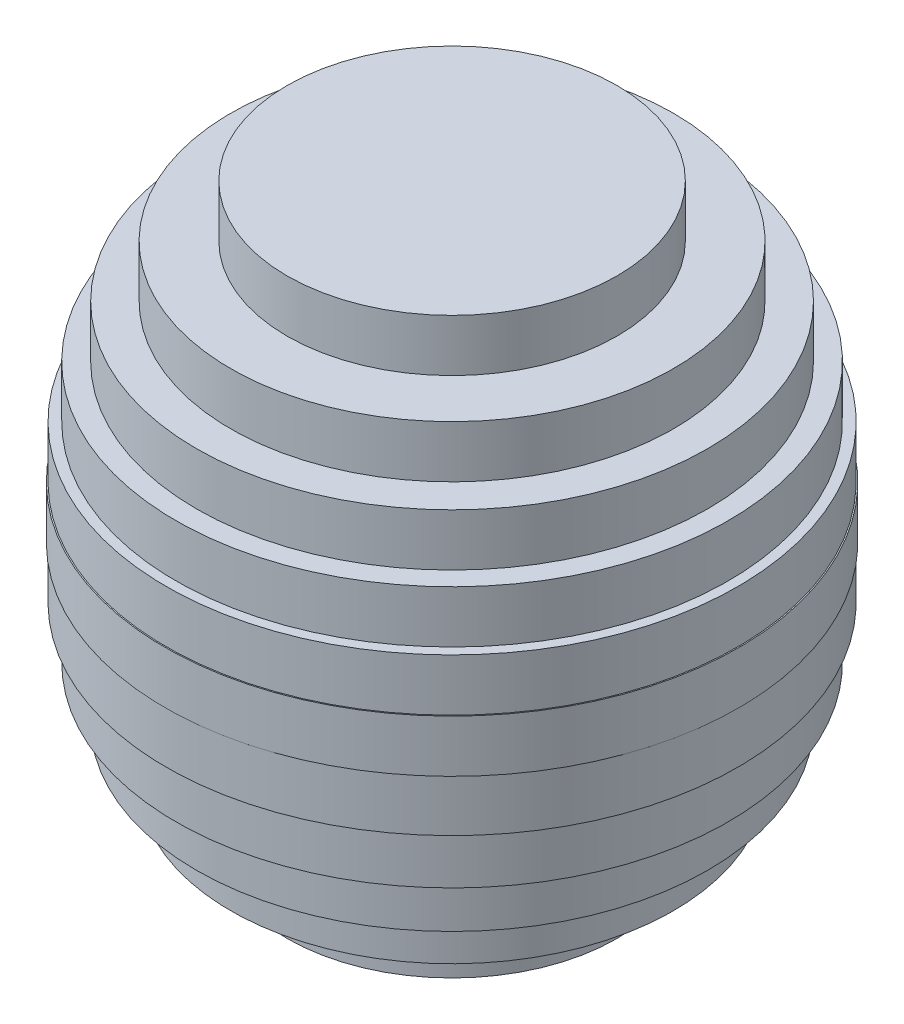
SolidWorks part; units mm, degrees
ref_plane "Front Plane" through (0, 0, 0) normal (0, 0, 1) x (1, 0, 0)
ref_plane "Top Plane" through (0, 0, 0) normal (0, 1, 0) x (1, 0, 0)
ref_plane "Right Plane" through (0, 0, 0) normal (1, 0, 0) x (0, 0, -1)
sketch "Sketch1" plane through (0, 0, 0) normal (0, 0, 1) x (1, 0, 0)
  line L0 (0, -27.5) -> (0, 27.5) construction
  line L1 (0, -27.5) -> (27.5, -27.5) construction
  line L2 (0, -22.5) -> (27.5, -22.5) construction
  line L3 (0, -17.5) -> (27.5, -17.5) construction
  line L4 (0, -12.5) -> (27.5, -12.5) construction
  line L5 (0, -7.5) -> (27.5, -7.5) construction
  line L6 (0, -2.5) -> (27.5, -2.5) construction
  line L7 (0, 2.5) -> (27.5, 2.5) construction
  line L35 (0, 7.5) -> (27.5, 7.5) construction
  line L36 (0, 12.5) -> (27.5, 12.5) construction
  line L37 (0, 17.5) -> (27.5, 17.5) construction
  line L38 (0, 22.5) -> (27.5, 22.5) construction
  arc A0 (0, 27.5) -> (0, -27.5) centre (0, 0) cw construction
  point P4 (0, 0)
  point P7 (27.5, 0)
  point P8 (0, 27.5)
sketch "Sketch2" plane through (0, 0, 0) normal (0, 0, 1) x (1, 0, 0)
  line L0 (27.5, 2.5) -> (27.5, -2.5)
  line L1 (27.5, -2.5) -> (27.3861, -2.5)
  line L2 (0, -2.5) -> (27.5, -2.5) construction
  line L3 (27.3861, -2.5) -> (27.3861, -7.5)
  line L4 (0, -7.5) -> (27.5, -7.5) construction
  line L5 (27.3861, -7.5) -> (26.4575, -7.5)
  line L6 (26.4575, -7.5) -> (26.4575, -12.5)
  line L7 (0, -12.5) -> (27.5, -12.5) construction
  line L8 (26.4575, -12.5) -> (24.4949, -12.5)
  line L9 (24.4949, -12.5) -> (24.4949, -17.5)
  line L10 (0, -17.5) -> (27.5, -17.5) construction
  line L11 (24.4949, -17.5) -> (21.2132, -17.5)
  line L12 (21.2132, -17.5) -> (21.2132, -22.5)
  line L13 (0, -22.5) -> (27.5, -22.5) construction
  line L14 (21.2132, -22.5) -> (15.8114, -22.5)
  line L15 (15.8114, -22.5) -> (15.8114, -27.5)
  line L16 (0, -27.5) -> (27.5, -27.5) construction
  line L17 (15.8114, -27.5) -> (0, -27.5)
  line L18 (0, -27.5) -> (0, 27.5)
  line L19 (0, 27.5) -> (15.8114, 27.5)
  line L20 (15.8114, 27.5) -> (15.8114, 22.5)
  line L21 (0, 22.5) -> (27.5, 22.5) construction
  line L22 (15.8114, 22.5) -> (21.2132, 22.5)
  line L23 (21.2132, 22.5) -> (21.2132, 17.5)
  line L24 (0, 17.5) -> (27.5, 17.5) construction
  line L25 (21.2132, 17.5) -> (24.4949, 17.5)
  line L26 (24.4949, 17.5) -> (24.4949, 12.5)
  line L27 (0, 12.5) -> (27.5, 12.5) construction
  line L28 (24.4949, 12.5) -> (26.4575, 12.5)
  line L29 (26.4575, 12.5) -> (26.4575, 7.5)
  line L30 (0, 7.5) -> (27.5, 7.5) construction
  line L31 (26.4575, 7.5) -> (27.3861, 7.5)
  line L32 (27.3861, 7.5) -> (27.3861, 2.5)
  line L33 (0, 2.5) -> (27.5, 2.5) construction
  line L34 (27.3861, 2.5) -> (27.5, 2.5)
  arc A0 (0, -27.5) -> (0, 27.5) centre (0, 0) ccw construction
revolve "Revolve2" add sketch "Sketch2" angle 360 about L18
equation "\"Ball Diameter\"= \"Layers\" * \"Layer Height\""
equation "\"Layers\"= 11"
equation "\"D1@Sketch1\"=\"Ball Diameter\""
equation "\"Layer Height\"= 5mm"
equation "\"D3@Sketch1\"=\"Layer Height\""
equation "\"D2@Sketch1\"=\"Layers\""
